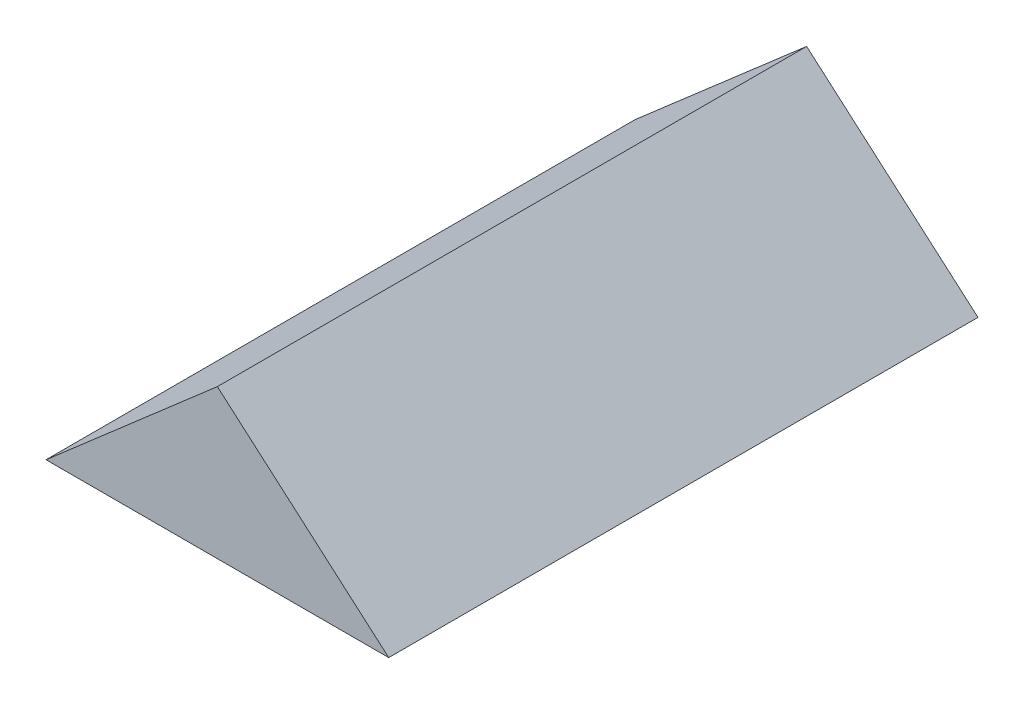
SolidWorks part; units mm, degrees
ref_plane "Plan de face" through (0, 0, 0) normal (0, 0, 1) x (1, 0, 0)
ref_plane "Plan de dessus" through (0, 0, 0) normal (0, 1, 0) x (1, 0, 0)
ref_plane "Plan de droite" through (0, 0, 0) normal (1, 0, 0) x (0, 0, -1)
sketch "Esquisse1" plane through (0, 0, 0) normal (0, 0, 1) x (1, 0, 0)
  line L0 (0, 0) -> (50.6, 0)
  line L1 (0, 0) -> (25.3, 22)
  line L2 (25.3, 22) -> (50.6, 0)
  dimension "D1" = 50.6
  dimension "D2" = 22
extrude "Extrusion1" add sketch "Esquisse1" along normal blind 87
